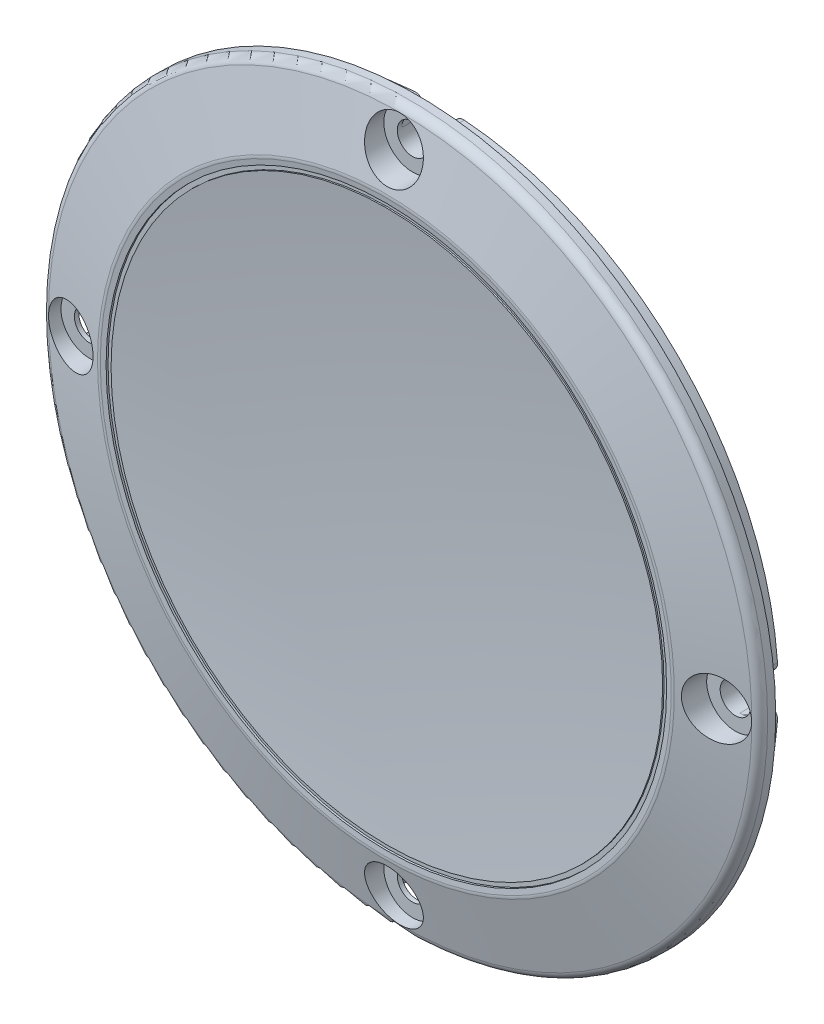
SolidWorks part; units mm, degrees
ref_plane "前视基准面" through (0, 0, 0) normal (0, 0, 1) x (1, 0, 0)
ref_plane "上视基准面" through (0, 0, 0) normal (0, 1, 0) x (1, 0, 0)
ref_plane "右视基准面" through (0, 0, 0) normal (1, 0, 0) x (0, 0, -1)
sketch "草图1" plane through (0, 0, 0) normal (0, 0, 1) x (1, 0, 0)
  circle A0 centre (0, 0) radius 40
  dimension "D1" = 80
extrude "凸台-拉伸1" add sketch "草图1" along normal blind 23
hole_wizard "打孔尺寸(%根据)内六角圆柱头螺钉的类型1" positions "草图2" profile "草图3" counterbore size "M3" standard "GB"
sketch "草图2" plane through (0, 0, 23) normal (0, 0, 1) x (1, 0, 0)
  line L0 (3.2931, 0) -> (-3.2931, 0) construction
  point P0 (36, 0)
  dimension "D1" = 36
sketch "草图3" plane through (36, 0, 23) normal (1, 0, 0) x (0, -1, 0)
  line L0 (0, 0) -> (0, 23)
  line L1 (0, 23) -> (1.7, 23)
  line L3 (1.7, 23) -> (1.7, 3)
  line L4 (1.7, 3) -> (3, 3)
  line L5 (3, 3) -> (3, 0)
  line L7 (3, 0) -> (0, 0)
  line L11 (0, -6.35) -> (0, 107.95) construction
  dimension "通孔孔直径" = 3.4
  dimension "通孔孔深度" = 23
  dimension "柱形沉头孔直径" = 6
  dimension "柱形沉头孔深度" = 3
pattern_circular "阵列(圆周)1" count 4 over 360 about axis through (0, 0, 0) along (0, 0, 1) of "打孔尺寸(%根据)内六角圆柱头螺钉的类型1"
sketch "草图4" plane through (0, 0, 0) normal (0, 0, -1) x (-1, 0, 0)
  circle A0 centre (0, 0) radius 36.25
  circle A1 centre (36, 0) radius 3.2
  circle A2 centre (0, 36) radius 3.2
  circle A3 centre (-36, 0) radius 3.2
  circle A4 centre (0, -36) radius 3.2
  dimension "D1" = 72.5
  dimension "D2" = 6.4
  dimension "D3" = 6.4
  dimension "D4" = 6.4
  dimension "D5" = 6.4
extrude "切除-拉伸1" cut sketch "草图4" against normal blind 19.5 contours A4 A0 A1 A2 A3
fillet "圆角6" radius 2 8 edges at (36.1086, -3.1982, 9.75) (36.1086, 3.1982, 9.75) (-3.1982, -36.1086, 9.75) (3.1982, -36.1086, 9.75) (-36.1086, 3.1982, 9.75) (-36.1086, -3.1982, 9.75) (3.1982, 36.1086, 9.75) (-3.1982, 36.1086, 9.75)
chamfer "倒角1" distance 1.8 distance2 8 1 edges at (40, 0, 23)
sketch "草图7" plane through (0, 0, 0) normal (0, 1, 0) x (1, 0, 0)
  line L0 (0, -23) -> (32, -23)
  line L1 (-32, -23) -> (32, -23) construction
  line L2 (0, -23) -> (-32, -23)
  line L3 (0, -23) -> (0, -21.2) construction
  line L4 (0, -3.2931) -> (0, 3.2931) construction
  arc A0 (-32, -23) -> (32, -23) centre (0, -306.5444) cw
  dimension "D1" = 32
  dimension "D2" = 32
  dimension "D3" = 1.8
revolve "切除-旋转1" cut sketch "草图7" angle 360 about L3
fillet "圆角3" radius 1 2 edges at (40, 0, 21.2) (32, 0, 23)
sketch "草图5" plane through (0, 0, 0) normal (0, 0, -1) x (-1, 0, 0)
  circle A0 centre (0, 0) radius 38
  dimension "D1" = 76
extrude "切除-拉伸2" cut sketch "草图5" against normal blind 4 flip side to cut
sketch "草图6" plane through (0, 0, 4) normal (0, 0, -1) x (-1, 0, 0)
  circle A2 centre (0, 0) radius 39.9
  circle A3 centre (0, 0) radius 39.9
  dimension "D1" = 0.1
extrude "切除-拉伸4" cut sketch "草图6" against normal blind 4 flip side to cut
sketch "草图9" plane through (0, 0, 0) normal (0, 0, -1) x (-1, 0, 0)
  line L0 (-1.7, 36) -> (-1.7, 41.1458)
  line L1 (-1.7, 41.1458) -> (1.7, 41.1458)
  line L2 (1.7, 41.1458) -> (1.7, 36)
  line L3 (36, 1.7) -> (41.1458, 1.7)
  line L4 (41.1458, 1.7) -> (41.1458, -1.7)
  line L5 (41.1458, -1.7) -> (36, -1.7)
  line L6 (1.7, -36) -> (1.7, -41.1458)
  line L7 (1.7, -41.1458) -> (-1.7, -41.1458)
  line L8 (-1.7, -41.1458) -> (-1.7, -36)
  line L9 (-36, -1.7) -> (-41.1458, -1.7)
  line L10 (-41.1458, -1.7) -> (-41.1458, 1.7)
  line L11 (-41.1458, 1.7) -> (-36, 1.7)
  circle A0 centre (0, 36) radius 1.7 construction
  arc A1 (-1.7, 36) -> (1.7, 36) centre (0, 36) ccw
  arc A2 (36, 1.7) -> (36, -1.7) centre (36, 0) ccw
  arc A3 (1.7, -36) -> (-1.7, -36) centre (0, -36) ccw
  arc A4 (-36, -1.7) -> (-36, 1.7) centre (-36, 0) ccw
  point P24 (0, 0)
  dimension "D1" = 4
extrude "切除-拉伸5" cut sketch "草图9" against normal up to surface (4 mm away)
chamfer "倒角2" distance 0.1 angle 45 1 edges at (-40, 0, 8)
chamfer "倒角3" distance 0.5 angle 45 1 edges at (-39.9, 0, 4)
chamfer "倒角4" distance 0.2 angle 45 4 edges at (2.8642, 36.8924, 21.8742) (38.9217, 0.681, 21.4413) (2.9572, -35.4952, 22.1859) (-33.0797, 0.6871, 22.7555)
other "删除面1"
other "移动面2" parameters "D1"=15.4
other "移动面3" parameters "D1"=1.1
other "移动面5" parameters "D1"=0.1
other "移动面6" parameters "D1"=0.5
sketch "草图11" plane through (0, 0, 19.5) normal (0, 0, -1) x (-1, 0, 0)
  circle A0 centre (0, 0) radius 31
  dimension "D1" = 62
extrude "切除-拉伸7" cut sketch "草图11" against normal blind 1
ref_plane "基准面1" through (0, 0, 23) normal (0, 0, -1) x (-1, 0, 0)
sketch "草图12" plane through (0, 0, 23) normal (0, 0, -1) x (-1, 0, 0)
  circle A0 centre (0, 0) radius 31.8331 construction
  circle A1 centre (0, 0) radius 31.25
  circle A2 centre (0, 0) radius 30.75
  dimension "D1" = 63.6662
  dimension "D2" = 62.5
  dimension "D3" = 0.5
extrude "切除-拉伸9" cut sketch "草图12" along normal blind 0.3
fillet "圆角8" radius 0.5 16 edges at (-35.6629, 3.789, 19.5) (-32.8, 0, 19.5) (-35.6629, -3.789, 19.5) (-25.6326, -25.6326, 19.5) (-3.789, -35.6629, 19.5) (0, -32.8, 19.5) (3.789, -35.6629, 19.5) (25.6326, -25.6326, 19.5) (35.6629, -3.789, 19.5) (32.8, 0, 19.5) (35.6629, 3.789, 19.5) (25.6326, 25.6326, 19.5) (3.789, 35.6629, 19.5) (0, 32.8, 19.5) (-3.789, 35.6629, 19.5) (-25.6326, 25.6326, 19.5)
sketch "草图13" plane through (0, 0, 20) normal (0, 0, 1) x (1, 0, 0)
  circle A0 centre (-36, 0) radius 3.2
  circle A1 centre (0, 36) radius 3.2
  circle A2 centre (36, 0) radius 3.2
  circle A3 centre (0, -36) radius 3.2
  dimension "D1" = 6.4
extrude "切除-拉伸10" cut sketch "草图13" along normal blind 10
other "移动面7" parameters "D1"=0.2
fillet "圆角7" radius 1 8 edges at (37.7618, -1.7, 18.25) (37.7618, 1.7, 18.25) (1.7, -37.7618, 18.25) (-1.7, -37.7618, 18.25) (-37.7618, -1.7, 18.25) (-37.7618, 1.7, 18.25) (-1.7, 37.7618, 18.25) (1.7, 37.7618, 18.25)
